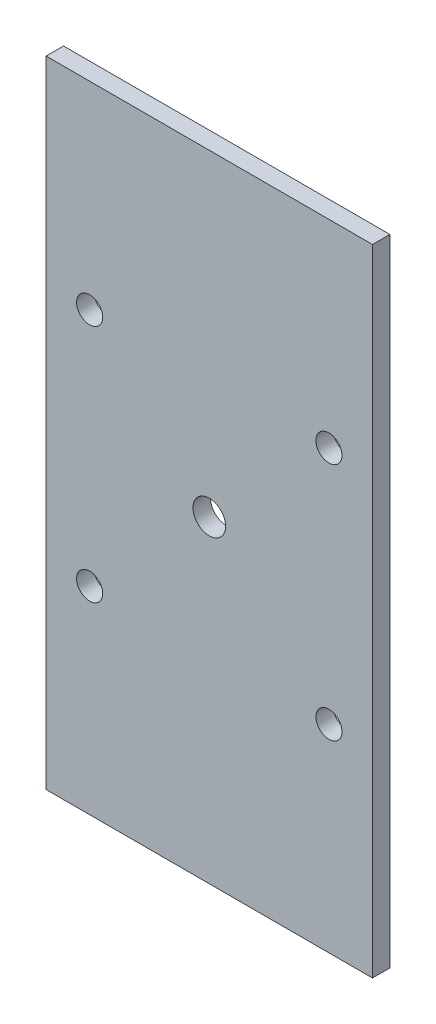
SolidWorks part; units mm, degrees
ref_plane "Front Plane" through (0, 0, 0) normal (1, 0, 0) x (0, 1, 0)
ref_plane "Top Plane" through (0, 0, 0) normal (0, 0, 1) x (0, 1, 0)
ref_plane "Right Plane" through (0, 0, 0) normal (0, 1, 0) x (-1, 0, 0)
sketch "Sketch1" plane through (0, 0, 0) normal (0, 0, 1) x (0, 1, 0)
  line L1 (-146, -75) -> (146, -75)
  line L2 (-146, -75) -> (-146, 75)
  line L3 (-146, 75) -> (146, 75)
  line L4 (146, -75) -> (146, 75)
  line L5 (-146, -75) -> (146, 75) construction
  line L6 (-146, 75) -> (146, -75) construction
  point P0 (0, 0)
  dimension "D1" = 292
  dimension "D2" = 150
extrude "Boss-Extrude1" add sketch "Sketch1" along normal blind 8
sketch "Sketch2" plane through (0, 0, 8) normal (0, 0, 1) x (1, 0, 0)
  line L0 (75, 146) -> (-75, 146) construction
  line L1 (-75, 146) -> (-75, -146) construction
  line L2 (75, -146) -> (75, 146) construction
  line L3 (-75, -146) -> (75, -146) construction
  circle A0 centre (-55, 55) radius 6
  circle A1 centre (55, 55) radius 6
  circle A2 centre (-55, -55) radius 6
  circle A3 centre (55, -55) radius 6
  dimension "D1" = 12
  dimension "D2" = 12
  dimension "D3" = 12
  dimension "D4" = 12
  dimension "D5" = 91
  dimension "D6" = 20
  dimension "D7" = 20
  dimension "D8" = 91
  dimension "D9" = 91
  dimension "D10" = 20
  dimension "D11" = 91
  dimension "D12" = 20
extrude "Cut-Extrude1" cut sketch "Sketch2" against normal through all
sketch "Sketch3" plane through (0, 0, 0) normal (0, 0, 1) x (0, 1, 0)
  circle A0 centre (0, 0) radius 7.5
  dimension "D1" = 15
extrude "Cut-Extrude2" cut sketch "Sketch3" along normal through all
